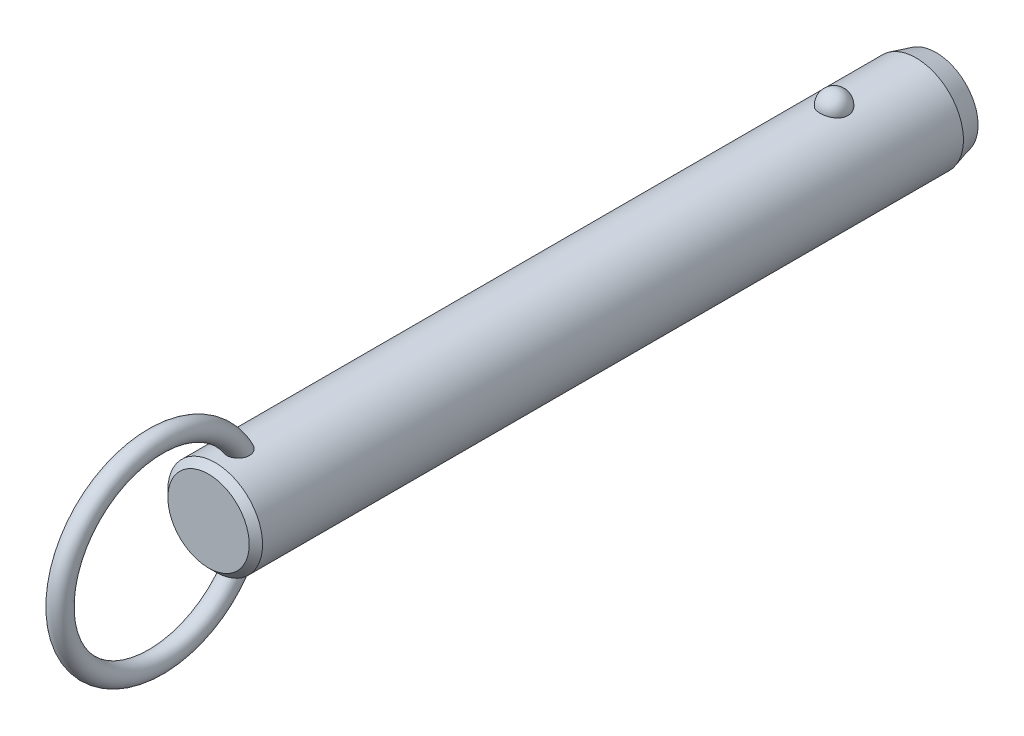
SolidWorks part; units mm, degrees
ref_plane "Front Plane" through (0, 0, 0) normal (0, 0, 1) x (1, 0, 0)
ref_plane "Top Plane" through (0, 0, 0) normal (0, 1, 0) x (1, 0, 0)
ref_plane "Right Plane" through (0, 0, 0) normal (1, 0, 0) x (0, 0, -1)
sketch "Sketch2" plane through (0, 0, 0) normal (0, 0, 1) x (1, 0, 0)
  circle A0 centre (0, 0) radius 7.1
  point P3 (0, 7.1)
  dimension "D1" = 14.2
extrude "Boss-Extrude1" add sketch "Sketch2" along normal blind 83.8
sketch "Sketch3" plane through (0, 0, 0) normal (0, 0, -1) x (-1, 0, 0)
  circle A0 centre (0, 0) radius 7.1
  dimension "D1" = 14.2
extrude "Boss-Extrude2" add sketch "Sketch3" along normal blind 17.4
chamfer "Chamfer1" distance 3 angle 15 1 edges at (-7.1, 0, -17.4)
sketch "Sketch12" plane through (0, 0, 0) normal (1, 0, 0) x (0, 0, -1)
  line L0 (-83.8, 7.1) -> (-83.8, -7.1) construction
  point P0 (-83.8, 0)
sketch "Sketch13" plane through (0, 0, 0) normal (1, 0, 0) x (0, 0, -1)
  circle A0 centre (-99.65, 0) radius 15.85
  point P2 (-83.8, 0)
  dimension "D1" = 31.7
sketch "Sketch14" plane through (0, 0, 0) normal (0, 1, 0) x (1, 0, 0)
  circle A0 centre (0, -85.3) radius 1.5
  point P2 (0, -83.8)
  dimension "D1" = 3
sweep "Sweep1" add profiles "Sketch14" path "Sketch13"
sketch "Sketch15" plane through (0, 0, 83.8) normal (0, 0, 1) x (1, 0, 0)
  circle A0 centre (0, 0) radius 7.1
  dimension "D1" = 14.2
extrude "Boss-Extrude3" add sketch "Sketch15" along normal blind 7.92
chamfer "Chamfer2" distance 1 angle 45 1 edges at (7.1, 0, 91.72)
sketch "Sketch18" plane through (0, 0, 0) normal (1, 0, 0) x (0, 0, -1)
  line L0 (14.4, 7.1) -> (-85.4792, 7.1) construction
  line L1 (2.1, 9.2) -> (2.1, 5)
  line L2 (-85.4792, -7.1) -> (14.4, -7.1) construction
  arc A0 (2.1, 9.2) -> (2.1, 5) centre (2.1, 7.1) ccw
  point P4 (0, 7.1)
  dimension "D1" = 16.3
revolve "Revolve1" add sketch "Sketch18" angle 360 about L1
